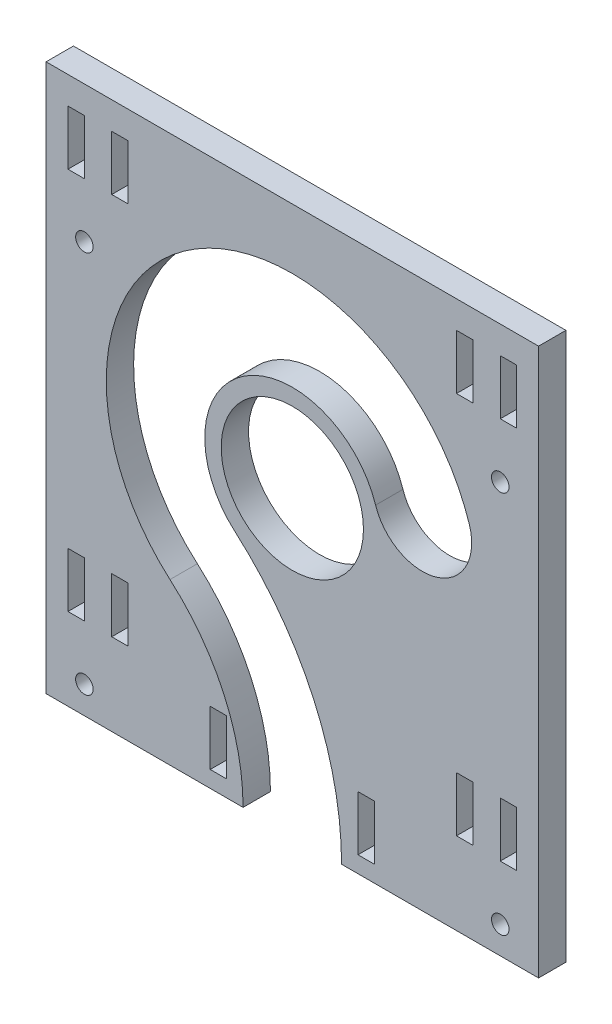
SolidWorks part; units mm, degrees
ref_plane "前视基准面" through (0, 0, 0) normal (0, 0, 1) x (1, 0, 0)
ref_plane "上视基准面" through (0, 0, 0) normal (0, 1, 0) x (1, 0, 0)
ref_plane "右视基准面" through (0, 0, 0) normal (1, 0, 0) x (0, 0, -1)
sketch "草图1" plane through (0, 0, 0) normal (0, 0, 1) x (1, 0, 0)
  line L0 (0, 0) -> (-23.7764, 7.7254) construction
  circle A0 centre (0, 0) radius 12.5
  circle A1 centre (0, 25) radius 12.5
  circle A2 centre (23.7764, 7.7254) radius 12.5
  circle A3 centre (14.6946, -20.2254) radius 12.5
  circle A4 centre (-14.6946, -20.2254) radius 12.5
  circle A5 centre (-23.7764, 7.7254) radius 12.5
  circle A6 centre (-23.7764, 7.7254) radius 10.5
  circle A7 centre (0, 25) radius 10.5
  circle A8 centre (23.7764, 7.7254) radius 10.5
  circle A9 centre (-14.6946, -20.2254) radius 10.5
  circle A10 centre (14.6946, -20.2254) radius 10.5
  circle A11 centre (-23.7764, 7.7254) radius 9
  circle A12 centre (0, 25) radius 9
  circle A13 centre (23.7764, 7.7254) radius 9
  circle A14 centre (14.6946, -20.2254) radius 9
  circle A15 centre (-14.6946, -20.2254) radius 9
  circle A17 centre (0, 0) radius 35.5
  point P16 (0, 0)
  dimension "D1" = 25
  dimension "D2" = 25
  dimension "D4" = 21
  dimension "D5" = 21
  dimension "D6" = 21
  dimension "D7" = 21
  dimension "D8" = 18
  dimension "D11" = 21
  dimension "D3" = 5
  dimension "D10" = 25
  dimension "D9" = 5
sketch "草图2" plane through (0, 0, 0) normal (0, 0, 1) x (1, 0, 0)
  line L0 (-10.5, 25) -> (-10.5, 27.9643)
  line L1 (10.5, 25) -> (10.5, 27.9643)
  line L2 (20.5317, 17.7115) -> (23.3509, 18.6275)
  line L3 (27.0211, -2.2607) -> (29.8403, -1.3447)
  line L4 (23.1893, -14.0537) -> (24.9317, -16.4518)
  line L5 (6.2, -26.3972) -> (7.9423, -28.7953)
  line L6 (-6.2, -26.3972) -> (-7.9423, -28.7953)
  line L7 (-23.1893, -14.0537) -> (-24.9317, -16.4518)
  line L8 (-27.0211, -2.2607) -> (-29.8403, -1.3447)
  line L9 (-20.5317, 17.7115) -> (-23.3509, 18.6275)
  line L11 (0, 0) -> (27.0211, -2.2607) construction
  circle A0 centre (14.6946, -20.2254) radius 10.5 construction
  circle A1 centre (-14.6946, -20.2254) radius 10.5 construction
  circle A2 centre (23.7764, 7.7254) radius 10.5 construction
  circle A3 centre (0, 25) radius 10.5 construction
  circle A4 centre (-23.7764, 7.7254) radius 10.5 construction
  circle A5 centre (0, 0) radius 35.5 construction
  arc A6 (23.1893, -14.0537) -> (6.2, -26.3972) centre (14.6946, -20.2254) ccw
  arc A7 (-6.2, -26.3972) -> (-23.1893, -14.0537) centre (-14.6946, -20.2254) ccw
  arc A8 (20.5317, 17.7115) -> (27.0211, -2.2607) centre (23.7764, 7.7254) ccw
  arc A9 (-10.5, 25) -> (10.5, 25) centre (0, 25) ccw
  arc A10 (-27.0211, -2.2607) -> (-20.5317, 17.7115) centre (-23.7764, 7.7254) ccw
  arc A11 (-16.3413, 31.5153) -> (-24.9231, 25.2802) centre (0, 0) ccw
  arc A12 (-35.0225, -5.8027) -> (-31.7446, -15.8912) centre (0, 0) ccw
  arc A13 (24.9231, 25.2802) -> (16.3413, 31.5153) centre (0, 0) ccw
  arc A14 (31.7446, -15.8912) -> (35.0225, -5.8027) centre (0, 0) ccw
  arc A15 (-5.3039, -35.1016) -> (5.3039, -35.1016) centre (0, 0) ccw
  arc A16 (23.3509, 18.6275) -> (24.9231, 25.2802) centre (22.1148, 22.4318) ccw
  arc A17 (10.5, 27.9643) -> (16.3413, 31.5153) centre (14.5, 27.9643) cw
  arc A18 (-10.5, 27.9643) -> (-16.3413, 31.5153) centre (-14.5, 27.9643) ccw
  arc A19 (-23.3509, 18.6275) -> (-24.9231, 25.2802) centre (-22.1148, 22.4318) cw
  arc A20 (24.9317, -16.4518) -> (31.7446, -15.8912) centre (28.1677, -14.1007) ccw
  arc A21 (7.9423, -28.7953) -> (5.3039, -35.1016) centre (4.7062, -31.1465) cw
  arc A22 (-7.9423, -28.7953) -> (-5.3039, -35.1016) centre (-4.7062, -31.1465) ccw
  arc A23 (-24.9317, -16.4518) -> (-31.7446, -15.8912) centre (-28.1677, -14.1007) cw
  arc A24 (-35.0225, -5.8027) -> (-29.8403, -1.3447) centre (-31.0763, -5.1489) cw
  arc A25 (29.8403, -1.3447) -> (35.0225, -5.8027) centre (31.0763, -5.1489) cw
  dimension "D2" = 4
  dimension "D3" = 4
  dimension "D1" = 5
sketch "草图3" plane through (0, 0, 0) normal (0, 0, 1) x (1, 0, 0)
  line L0 (-45, 45) -> (45, 45)
  line L1 (45, 45) -> (45, -45)
  line L3 (-45, -45) -> (-45, 45)
  line L4 (-45, -45) -> (-45, -55)
  line L6 (45, -55) -> (45, -45)
  line L9 (9, -55) -> (45, -55)
  line L10 (-45, -55) -> (-9, -55)
  arc A18 (15.2169, 4.9443) -> (-10.5205, -12.0548) centre (0, 0) ccw
  arc A19 (32.3359, 10.5066) -> (-22.3562, -25.6164) centre (0, 0) ccw
  arc A21 (-9, -55) -> (-22.3562, -25.6164) centre (-48, -55) ccw
  arc A22 (9, -55) -> (-10.5205, -12.0548) centre (-48, -55) ccw
  circle A23 centre (23.7764, 7.7254) radius 9 construction
  arc A24 (15.2169, 4.9443) -> (32.3359, 10.5066) centre (23.7764, 7.7254) ccw
  dimension "D4" = 90
  dimension "D1" = 114
  dimension "D2" = 90
  dimension "D3" = 10
extrude "凸台-拉伸2" add sketch "草图3" along normal blind 5
sketch "草图4" plane through (0, 0, 5) normal (0, 0, 1) x (1, 0, 0)
  circle A0 centre (0, 0) radius 13
  dimension "D1" = 26
extrude "切除-拉伸1" cut sketch "草图4" against normal blind 5
sketch "草图5" plane through (0, 0, 5) normal (0, 0, 1) x (1, 0, 0)
  line L0 (-33, 40) -> (-33, 30)
  line L1 (-33, 30) -> (-30, 30)
  line L2 (-30, 30) -> (-30, 40)
  line L3 (-30, 40) -> (-33, 40)
  line L4 (30, 40) -> (30, 30)
  line L5 (30, 30) -> (33, 30)
  line L6 (33, 30) -> (33, 40)
  line L7 (33, 40) -> (30, 40)
  line L8 (-33, -30) -> (-33, -40)
  line L9 (-33, -40) -> (-30, -40)
  line L10 (-30, -40) -> (-30, -30)
  line L11 (-30, -30) -> (-33, -30)
  line L12 (30, -30) -> (30, -40)
  line L13 (30, -40) -> (33, -40)
  line L14 (33, -40) -> (33, -30)
  line L15 (33, -30) -> (30, -30)
  line L16 (0, 45) -> (0, -54.353) construction
  line L17 (-45, 45) -> (45, 45) construction
  line L18 (-45, 0) -> (45, 0) construction
  line L19 (-45, -55) -> (-45, 45) construction
  line L20 (45, -55) -> (45, 45) construction
  dimension "D1" = 3
  dimension "D2" = 10
  dimension "D3" = 10
  dimension "D4" = 3
  dimension "D5" = 10
  dimension "D6" = 3
  dimension "D7" = 3
  dimension "D8" = 10
  dimension "D9" = 30
  dimension "D10" = 30
  dimension "D11" = 30
  dimension "D12" = 30
  dimension "D13" = 30
  dimension "D14" = 30
  dimension "D15" = 30
  dimension "D16" = 30
extrude "切除-拉伸2" cut sketch "草图5" against normal blind 5
sketch "草图6" plane through (0, 0, 5) normal (0, 0, 1) x (1, 0, 0)
  line L0 (0, 45) -> (0, -55.3958) construction
  line L1 (-45, 45) -> (45, 45) construction
  line L2 (-15, -42) -> (-12, -42)
  line L3 (-12, -42) -> (-12, -52)
  line L4 (-12, -52) -> (-15, -52)
  line L5 (-15, -52) -> (-15, -42)
  line L6 (12, -42) -> (12, -52)
  line L7 (12, -52) -> (15, -52)
  line L8 (15, -52) -> (15, -42)
  line L9 (15, -42) -> (12, -42)
  line L10 (-45, -55) -> (-9, -55) construction
  line L11 (9, -55) -> (45, -55) construction
  line L12 (38, -30) -> (38, -40)
  line L13 (38, -40) -> (41, -40)
  line L14 (41, -40) -> (41, -30)
  line L15 (41, -30) -> (38, -30)
  line L16 (38, 30) -> (38, 40)
  line L17 (38, 40) -> (41, 40)
  line L18 (41, 40) -> (41, 30)
  line L19 (41, 30) -> (38, 30)
  line L20 (-38, 40) -> (-41, 40)
  line L21 (-41, 40) -> (-41, 30)
  line L22 (-41, 30) -> (-38, 30)
  line L23 (-38, 30) -> (-38, 40)
  line L24 (-41, -30) -> (-41, -40)
  line L25 (-41, -40) -> (-38, -40)
  line L26 (-38, -40) -> (-38, -30)
  line L27 (-38, -30) -> (-41, -30)
  line L28 (33, -40) -> (33, -30) construction
  line L29 (30, -40) -> (33, -40) construction
  line L30 (30, 30) -> (33, 30) construction
  line L31 (-33, 40) -> (-33, 30) construction
  line L33 (-33, -40) -> (-30, -40) construction
  line L34 (-45, -55) -> (-45, 45) construction
  line L35 (-45, 20) -> (45, 20) construction
  line L36 (45, -55) -> (45, 45) construction
  circle A0 centre (-38, -50) radius 1.6
  circle A1 centre (38, -50) radius 1.6
  circle A2 centre (-38, 20) radius 1.6
  circle A3 centre (38, 20) radius 1.6
  point P36 (38, -35)
  dimension "D18" = 3.2
  dimension "D19" = 7
  dimension "D20" = 5
  dimension "D1" = 3
  dimension "D2" = 10
  dimension "D3" = 12
  dimension "D4" = 3
  dimension "D5" = 12
  dimension "D6" = 3
  dimension "D7" = 10
  dimension "D8" = 3
  dimension "D9" = 3
  dimension "D10" = 3
  dimension "D11" = 3
  dimension "D12" = 5
  dimension "D13" = 10
  dimension "D14" = 10
  dimension "D15" = 5
  dimension "D16" = 10
  dimension "D17" = 10
  dimension "D21" = 3
  dimension "D22" = 25
extrude "切除-拉伸3" cut sketch "草图6" against normal blind 10
